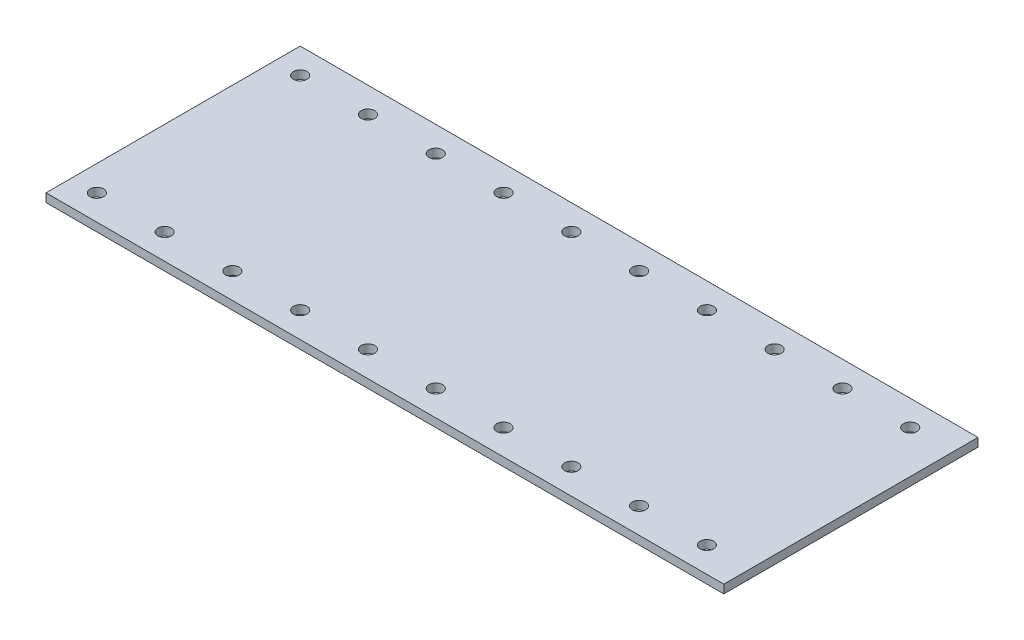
SolidWorks part; units mm, degrees
other "Connection Feature" parameters "D1"=64.3461, "D2"=158.0247
ref_plane "Front Plane" through (0, 0, 0) normal (0, 0, 1) x (1, 0, 0)
ref_plane "Top Plane" through (0, 0, 0) normal (0, 1, 0) x (1, 0, 0)
ref_plane "Right Plane" through (0, 0, 0) normal (1, 0, 0) x (0, 0, -1)
sketch "Sketch1" plane through (0, 0, 0) normal (0, 1, 0) x (1, 0, 0)
  line L1 (-100, 37.5) -> (100, 37.5)
  line L2 (-100, 37.5) -> (-100, -37.5)
  line L3 (-100, -37.5) -> (100, -37.5)
  line L4 (100, 37.5) -> (100, -37.5)
  line L5 (-100, 37.5) -> (100, -37.5) construction
  line L6 (-100, -37.5) -> (100, 37.5) construction
  point P0 (0, 0)
extrude "Boss-Extrude1" add sketch "Sketch1" along normal blind 2.5
hole_wizard "Ø4.0mm Dowel Hole1" positions "Sketch3" profile "Sketch4" hole size "Ø4.0" standard "ANSI Metric"
sketch "Sketch3" plane through (0, 2.5, 0) normal (0, 1, 0) x (1, 0, 0)
  line L0 (100, 37.5) -> (-100, 37.5) construction
  line L1 (-100, 37.5) -> (-100, -37.5) construction
  line L2 (0, 0) -> (-100, 0) construction
  line L4 (-92.5, 30) -> (-92.5, -30) construction
  point P0 (-92.5, 30)
  point P2 (-92.5, -30)
  point P17 (-92.5, 0)
  dimension "D1" = 7.5
  dimension "D2" = 7.5
sketch "Sketch4" plane through (-92.5, 2.5, -30) normal (1, 0, 0) x (0, 0, 1)
  line L0 (0, 0) -> (0, 2.5)
  line L1 (0, 2.5) -> (2.025, 2.5)
  line L2 (2, 2.475) -> (2, 0)
  line L5 (2, 0) -> (0, 0)
  line L7 (2.025, 2.5) -> (2, 2.475)
  line L8 (-2.025, 2.5) -> (-2, 2.475) construction
  line L11 (0, -6.35) -> (0, 107.95) construction
  dimension "Thru Hole Dia." = 4
  dimension "Thru Hole Depth" = 2.5
  dimension "Far C'Sink Dia." = 4.05
  dimension "Far C'Sink Angle" = 90
pattern_linear "LPattern1" count 10 spacing 20 along (1, 0, 0) of "Ø4.0mm Dowel Hole1"
other "Configuration Table"
